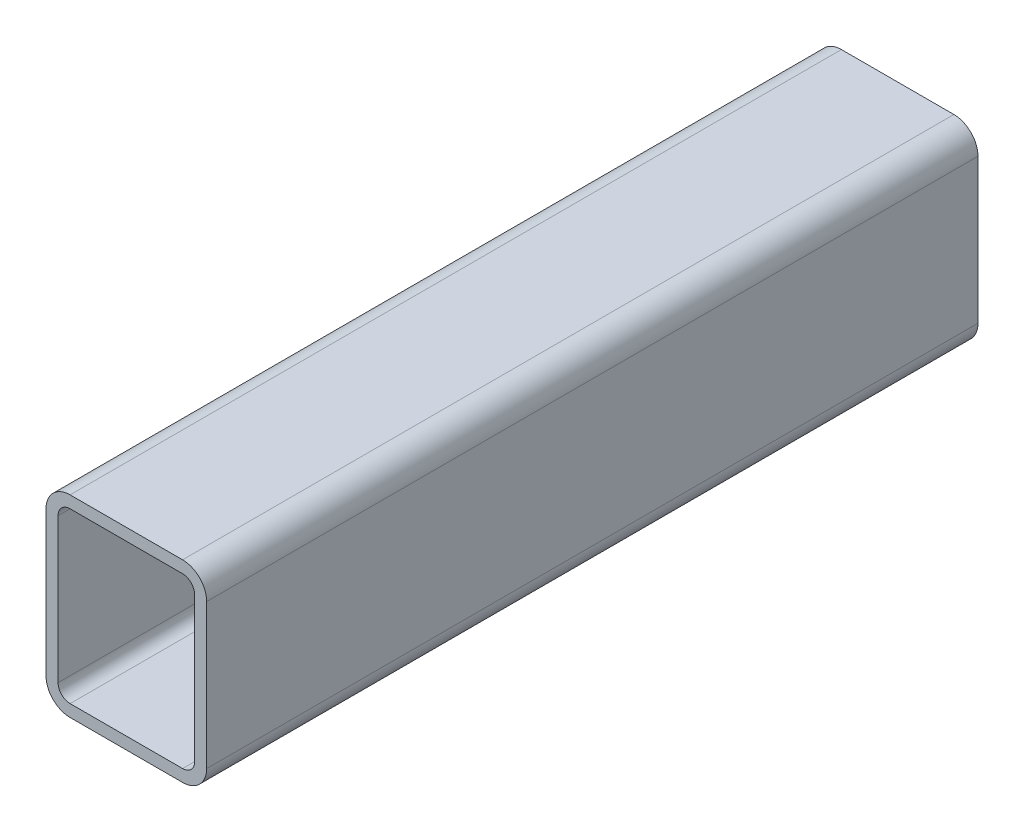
SolidWorks part; units mm, degrees
ref_plane "Front Plane" through (0, 0, 0) normal (0, 0, 1) x (1, 0, 0)
ref_plane "Top Plane" through (0, 0, 0) normal (0, 1, 0) x (1, 0, 0)
ref_plane "Right Plane" through (0, 0, 0) normal (1, 0, 0) x (0, 0, -1)
sketch "Sketch1" plane through (0, 0, 0) normal (0, 0, 1) x (1, 0, 0)
sketch_block_instance "HSS3x2.5x0.1875-1"
sketch_block "HSS3x2.5x0.1875"
extrude "Boss-Extrude1" add sketch "Sketch1" along normal blind 304.8
